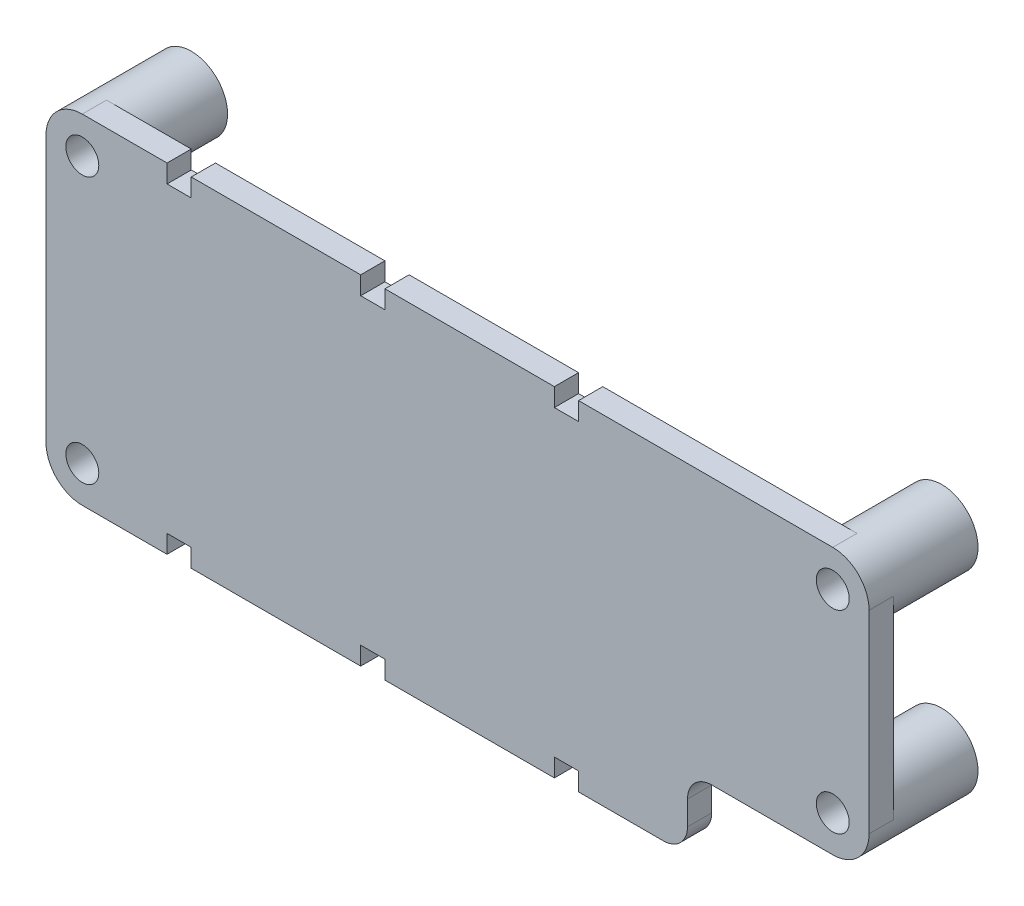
SolidWorks part; units mm, degrees
ref_plane "Front Plane" through (0, 0, 0) normal (0, 0, 1) x (1, 0, 0)
ref_plane "Top Plane" through (0, 0, 0) normal (0, 1, 0) x (1, 0, 0)
ref_plane "Right Plane" through (0, 0, 0) normal (1, 0, 0) x (0, 0, -1)
sketch "Sketch1" plane through (0, 0, 0) normal (0, 0, 1) x (1, 0, 0)
  circle A0 centre (-27.94, 20.32) radius 3.81
  circle A1 centre (-27.94, -7.62) radius 3.81
  circle A2 centre (50.8, 20.32) radius 3.81
  circle A3 centre (50.8, 0) radius 3.81
extrude "Boss-Extrude1" add sketch "Sketch1" along normal blind 8.89
sketch "Sketch2" plane through (0, 0, 8.89) normal (0, 0, 1) x (1, 0, 0)
  line L0 (35.56, -6.35) -> (35.56, -8.89)
  line L1 (-27.94, 24.13) -> (50.8, 24.13)
  line L2 (-31.75, 20.32) -> (-31.75, -7.62)
  line L3 (-27.94, -11.43) -> (33.02, -11.43)
  line L4 (54.61, 20.32) -> (54.61, 0)
  line L5 (50.8, -3.81) -> (38.1, -3.81)
  circle A0 centre (-27.94, 20.32) radius 3.81 construction
  circle A1 centre (-27.94, -7.62) radius 3.81 construction
  circle A2 centre (50.8, 20.32) radius 3.81 construction
  arc A3 (-31.75, -7.62) -> (-27.94, -11.43) centre (-27.94, -7.62) ccw
  arc A4 (-27.94, 24.13) -> (-31.75, 20.32) centre (-27.94, 20.32) ccw
  circle A5 centre (50.8, 0) radius 3.81 construction
  arc A7 (54.61, 20.32) -> (50.8, 24.13) centre (50.8, 20.32) ccw
  arc A8 (50.8, -3.81) -> (54.61, 0) centre (50.8, 0) ccw
  arc A9 (33.02, -11.43) -> (35.56, -8.89) centre (33.02, -8.89) ccw
  arc A10 (38.1, -3.81) -> (35.56, -6.35) centre (38.1, -6.35) ccw
  dimension "D1" = 2.54
  dimension "D3" = 2.54
  dimension "D2" = 19.05
extrude "Boss-Extrude2" add sketch "Sketch2" along normal blind 2.54
hole_wizard "#4 Clearance Hole1" positions "Sketch4" profile "Sketch5" hole size "#4" standard "ANSI Inch"
sketch "Sketch4" plane through (0, 0, 11.43) normal (0, 0, 1) x (1, 0, 0)
  point P0 (-27.94, 20.32)
  point P3 (-27.94, -7.62)
  point P9 (50.8, 0)
  point P12 (50.8, 20.32)
sketch "Sketch5" plane through (-27.94, 20.32, 11.43) normal (1, 0, 0) x (0, -1, 0)
  line L0 (0, 0) -> (0, 11.43)
  line L1 (0, 11.43) -> (1.7272, 11.43)
  line L2 (1.7272, 11.43) -> (1.7272, 0)
  line L5 (1.7272, 0) -> (0, 0)
  line L11 (0, -6.35) -> (0, 107.95) construction
  dimension "Thru Hole Dia." = 3.4544
  dimension "Thru Hole Depth" = 11.43
sketch "Sketch6" plane through (0, 0, 11.43) normal (0, 0, 1) x (1, 0, 0)
  line L1 (-27.94, -11.43) -> (33.02, -11.43) construction
  line L2 (21.59, -11.43) -> (24.13, -11.43)
  line L3 (-31.75, 20.32) -> (-31.75, -7.62) construction
  line L4 (50.8, 24.13) -> (-27.94, 24.13) construction
  line L5 (-19.05, 24.13) -> (-16.51, 24.13)
  line L6 (-19.05, 24.13) -> (-19.05, 22.225)
  line L7 (-19.05, 22.225) -> (-16.51, 22.225)
  line L8 (-16.51, 24.13) -> (-16.51, 22.225)
  line L9 (-16.51, 22.225) -> (1.27, 22.225) construction
  line L10 (1.27, 24.13) -> (3.81, 24.13)
  line L11 (1.27, 24.13) -> (1.27, 22.225)
  line L12 (1.27, 22.225) -> (3.81, 22.225)
  line L13 (3.81, 24.13) -> (3.81, 22.225)
  line L14 (-27.94, -11.43) -> (33.02, -11.43) construction
  line L15 (21.59, -11.43) -> (21.59, -9.525)
  line L16 (-19.05, -11.43) -> (-16.51, -11.43)
  line L17 (-19.05, -11.43) -> (-19.05, -9.525)
  line L18 (-19.05, -9.525) -> (-16.51, -9.525)
  line L19 (-16.51, -11.43) -> (-16.51, -9.525)
  line L20 (1.27, -11.43) -> (3.81, -11.43)
  line L21 (1.27, -11.43) -> (1.27, -9.525)
  line L22 (1.27, -9.525) -> (3.81, -9.525)
  line L23 (3.81, -11.43) -> (3.81, -9.525)
  line L24 (21.59, -9.525) -> (24.13, -9.525)
  line L25 (24.13, -11.43) -> (24.13, -9.525)
  line L27 (21.59, 24.13) -> (24.13, 24.13)
  line L28 (21.59, 24.13) -> (21.59, 22.225)
  line L29 (21.59, 22.225) -> (24.13, 22.225)
  line L30 (24.13, 24.13) -> (24.13, 22.225)
  point P18 (-7.62, 22.225)
  dimension "D4" = 17.78
  dimension "D1" = 17.78
  dimension "D2" = 2.54
  dimension "D3" = 1.905
  dimension "D5" = 12.7
extrude "Cut-Extrude1" cut sketch "Sketch6" against normal up to surface (2.54 mm away)
